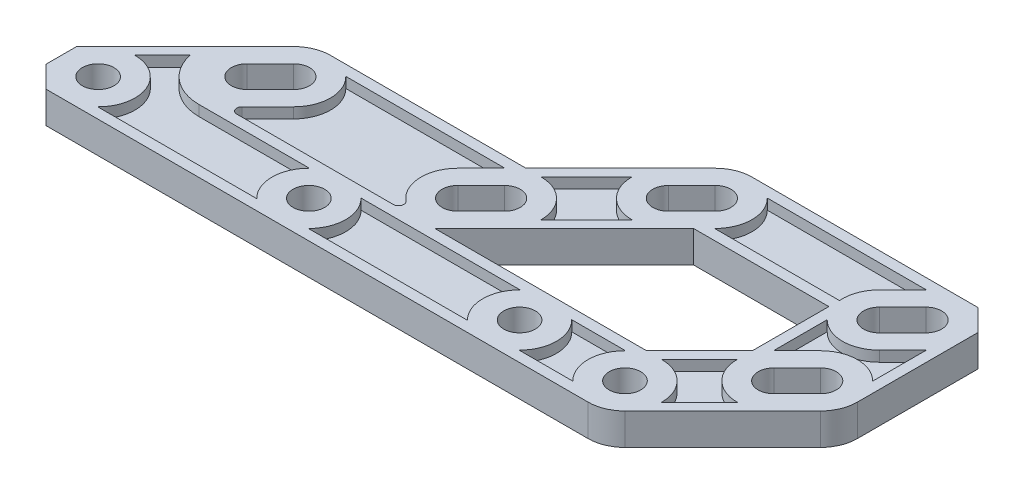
SolidWorks part; units mm, degrees
ref_plane "Front" through (0, 0, 0) normal (0, 0, 1) x (1, 0, 0)
ref_plane "Top" through (0, 0, 0) normal (0, 1, 0) x (1, 0, 0)
ref_plane "Right" through (0, 0, 0) normal (1, 0, 0) x (0, 0, -1)
sketch "Esquisse1" plane through (0, 0, 0) normal (0, 1, 0) x (1, 0, 0)
  line L0 (0, 0) -> (50, 0) construction
  line L1 (0, 3.5) -> (50, 3.5)
  line L2 (0, -3.5) -> (50, -3.5)
  line L3 (57.0711, 7.0711) -> (59.2783, 9.2783) construction
  line L4 (54.5962, 9.5459) -> (56.8034, 11.7531)
  line L5 (59.5459, 4.5962) -> (61.7531, 6.8034)
  line L6 (57.0711, 7.0711) -> (59.2783, 9.2783) construction
  line L7 (56.0104, 8.1317) -> (58.2176, 10.3389)
  line L8 (58.1317, 6.0104) -> (60.3389, 8.2176)
  line L9 (58.1317, 16.0104) -> (60.3389, 18.2176)
  line L10 (56.0104, 18.1317) -> (58.2176, 20.3389)
  line L11 (59.5459, 14.5962) -> (61.7531, 16.8034)
  line L12 (54.5962, 19.5459) -> (56.8034, 21.7531)
  line L13 (57.0711, 17.0711) -> (59.2783, 19.2783) construction
  line L14 (57.0711, 17.0711) -> (59.2783, 19.2783) construction
  line L15 (20, 0) -> (39.2783, 19.2783) construction
  line L16 (39.2783, 19.2783) -> (59.2783, 19.2783) construction
  line L17 (27.0711, 7.0711) -> (29.2783, 9.2783) construction
  line L18 (24.5962, 9.5459) -> (26.8034, 11.7531)
  line L19 (29.5459, 4.5962) -> (31.7531, 6.8034)
  line L20 (27.0711, 7.0711) -> (29.2783, 9.2783) construction
  line L21 (26.0104, 8.1317) -> (28.2176, 10.3389)
  line L22 (28.1317, 6.0104) -> (30.3389, 8.2176)
  line L23 (39.2783, 19.2783) -> (37.0711, 17.0711) construction
  line L24 (41.7531, 16.8034) -> (39.5459, 14.5962)
  line L25 (36.8034, 21.7531) -> (34.5962, 19.5459)
  line L26 (39.2783, 19.2783) -> (37.0711, 17.0711) construction
  line L27 (40.3389, 18.2176) -> (38.1317, 16.0104)
  line L28 (38.2176, 20.3389) -> (36.0104, 18.1317)
  line L29 (0, 0) -> (9.2783, 9.2783) construction
  line L30 (9.2783, 9.2783) -> (29.2783, 9.2783) construction
  line L31 (9.2783, 9.2783) -> (7.0711, 7.0711) construction
  line L32 (11.7531, 6.8034) -> (9.5459, 4.5962)
  line L33 (6.8034, 11.7531) -> (4.5962, 9.5459)
  line L34 (9.2783, 9.2783) -> (7.0711, 7.0711) construction
  line L35 (10.3389, 8.2176) -> (8.1317, 6.0104)
  line L36 (8.2176, 10.3389) -> (6.0104, 8.1317)
  line L38 (-1.4497, 3.5) -> (-3.5, 1.4497)
  line L39 (-3.5, 1.4497) -> (-3.5, -1.4497)
  line L40 (-3.5, -1.4497) -> (-1.4497, -3.5)
  line L41 (-1.4497, -3.5) -> (1.4497, -3.5)
  line L42 (1.4497, -3.5) -> (3.5, -1.4497)
  line L43 (3.5, -1.4497) -> (3.5, 1.4497)
  line L44 (3.5, 1.4497) -> (1.4497, 3.5)
  line L45 (1.4497, 3.5) -> (-1.4497, 3.5)
  line L46 (62.7783, 20.728) -> (60.728, 22.7783)
  line L47 (60.728, 22.7783) -> (57.8285, 22.7783)
  line L48 (57.8285, 22.7783) -> (55.7783, 20.728)
  line L49 (55.7783, 20.728) -> (55.7783, 17.8285)
  line L50 (55.7783, 17.8285) -> (57.8285, 15.7783)
  line L51 (57.8285, 15.7783) -> (60.728, 15.7783)
  line L52 (60.728, 15.7783) -> (62.7783, 17.8285)
  line L53 (62.7783, 17.8285) -> (62.7783, 20.728)
  circle A0 centre (0, 0) radius 1.5
  circle A1 centre (10, 0) radius 1.5
  circle A2 centre (20, 0) radius 1.5
  circle A3 centre (30, 0) radius 1.5
  circle A4 centre (40, 0) radius 1.5
  circle A5 centre (50, 0) radius 1.5
  arc A7 (0, 3.5) -> (0, -3.5) centre (0, 0) ccw
  arc A8 (50, -3.5) -> (50, 3.5) centre (50, 0) ccw
  arc A9 (54.5962, 9.5459) -> (59.5459, 4.5962) centre (57.0711, 7.0711) ccw
  arc A10 (61.7531, 6.8034) -> (56.8034, 11.7531) centre (59.2783, 9.2783) ccw
  arc A11 (56.0104, 8.1317) -> (58.1317, 6.0104) centre (57.0711, 7.0711) ccw
  arc A12 (60.3389, 8.2176) -> (58.2176, 10.3389) centre (59.2783, 9.2783) ccw
  arc A13 (56.0104, 18.1317) -> (58.1317, 16.0104) centre (57.0711, 17.0711) ccw
  arc A14 (60.3389, 18.2176) -> (58.2176, 20.3389) centre (59.2783, 19.2783) ccw
  arc A15 (54.5962, 19.5459) -> (59.5459, 14.5962) centre (57.0711, 17.0711) ccw
  arc A16 (61.7531, 16.8034) -> (56.8034, 21.7531) centre (59.2783, 19.2783) ccw
  arc A17 (24.5962, 9.5459) -> (29.5459, 4.5962) centre (27.0711, 7.0711) ccw
  arc A18 (31.7531, 6.8034) -> (26.8034, 11.7531) centre (29.2783, 9.2783) ccw
  arc A19 (26.0104, 8.1317) -> (28.1317, 6.0104) centre (27.0711, 7.0711) ccw
  arc A20 (30.3389, 8.2176) -> (28.2176, 10.3389) centre (29.2783, 9.2783) ccw
  arc A21 (41.7531, 16.8034) -> (36.8034, 21.7531) centre (39.2783, 19.2783) ccw
  arc A22 (34.5962, 19.5459) -> (39.5459, 14.5962) centre (37.0711, 17.0711) ccw
  arc A23 (40.3389, 18.2176) -> (38.2176, 20.3389) centre (39.2783, 19.2783) ccw
  arc A24 (36.0104, 18.1317) -> (38.1317, 16.0104) centre (37.0711, 17.0711) ccw
  arc A25 (11.7531, 6.8034) -> (6.8034, 11.7531) centre (9.2783, 9.2783) ccw
  arc A26 (4.5962, 9.5459) -> (9.5459, 4.5962) centre (7.0711, 7.0711) ccw
  arc A27 (10.3389, 8.2176) -> (8.2176, 10.3389) centre (9.2783, 9.2783) ccw
  arc A28 (6.0104, 8.1317) -> (8.1317, 6.0104) centre (7.0711, 7.0711) ccw
  circle A29 centre (0, 0) radius 3.5 construction
  circle A30 centre (59.2783, 19.2783) radius 3.5 construction
  point P3 (25, 0)
  point P20 (58.1747, 8.1747)
  point P27 (58.1747, 8.1747)
  point P36 (58.1747, 18.1747)
  point P43 (58.1747, 18.1747)
  point P50 (28.1747, 8.1747)
  point P55 (28.1747, 8.1747)
  point P62 (38.1747, 18.1747)
  point P70 (38.1747, 18.1747)
  point P78 (8.1747, 8.1747)
  point P86 (8.1747, 8.1747)
  dimension "D1" = 3
  dimension "D4" = 7
  dimension "D5" = 3.5
  dimension "D9" = 1.5
  dimension "D3" = 20
  dimension "D6" = 45
  dimension "D7" = 10
  dimension "D8" = 60
  dimension "D11" = 10
  dimension "D12" = 45
  dimension "D2" = 6
  dimension "D10" = 2
sketch "Esquisse2" plane through (0, 0, 0) normal (0, 1, 0) x (1, 0, 0)
  line L0 (0, -3.5) -> (50, -3.5) construction
  line L1 (-1.4497, -3.5) -> (50, -3.5)
  line L2 (59.5459, 4.5962) -> (61.7531, 6.8034) construction
  line L3 (52.4749, -2.4749) -> (61.7531, 6.8034)
  line L4 (36.8034, 21.7531) -> (34.5962, 19.5459) construction
  line L5 (36.8034, 21.7531) -> (27.8285, 12.7783)
  line L6 (6.8034, 11.7531) -> (4.5962, 9.5459) construction
  line L7 (6.8034, 11.7531) -> (-3.5, 1.4497)
  line L8 (62.7783, 9.2783) -> (62.7783, 20.728)
  line L9 (60.728, 22.7783) -> (39.2783, 22.7783)
  line L10 (9.2783, 12.7783) -> (27.8285, 12.7783)
  line L11 (58.1317, 6.0104) -> (60.3389, 8.2176) construction
  line L12 (56.0104, 8.1317) -> (58.2176, 10.3389) construction
  line L13 (58.1317, 6.0104) -> (60.3389, 8.2176)
  line L14 (56.0104, 8.1317) -> (58.2176, 10.3389)
  line L15 (56.0104, 18.1317) -> (58.2176, 20.3389) construction
  line L16 (58.1317, 16.0104) -> (60.3389, 18.2176) construction
  line L17 (56.0104, 18.1317) -> (58.2176, 20.3389)
  line L18 (58.1317, 16.0104) -> (60.3389, 18.2176)
  line L19 (38.2176, 20.3389) -> (36.0104, 18.1317) construction
  line L20 (40.3389, 18.2176) -> (38.1317, 16.0104) construction
  line L21 (38.2176, 20.3389) -> (36.0104, 18.1317)
  line L22 (40.3389, 18.2176) -> (38.1317, 16.0104)
  line L23 (26.0104, 8.1317) -> (28.2176, 10.3389) construction
  line L24 (28.1317, 6.0104) -> (30.3389, 8.2176) construction
  line L25 (26.0104, 8.1317) -> (28.2176, 10.3389)
  line L26 (28.1317, 6.0104) -> (30.3389, 8.2176)
  line L27 (10.3389, 8.2176) -> (8.1317, 6.0104) construction
  line L28 (8.2176, 10.3389) -> (6.0104, 8.1317) construction
  line L29 (10.3389, 8.2176) -> (8.1317, 6.0104)
  line L30 (8.2176, 10.3389) -> (6.0104, 8.1317)
  line L31 (29.5459, 4.5962) -> (31.7531, 6.8034) construction
  line L32 (0, 3.5) -> (50, 3.5) construction
  line L33 (28.4497, 3.5) -> (40.728, 15.7783)
  line L34 (28.4497, 3.5) -> (48.5503, 3.5)
  line L35 (54.5962, 9.5459) -> (56.8034, 11.7531) construction
  line L36 (48.5503, 3.5) -> (53.5711, 8.5208)
  line L37 (53.5711, 15.7783) -> (53.5711, 8.5208)
  line L38 (53.5711, 15.7783) -> (40.728, 15.7783)
  line L39 (-3.5, -1.4497) -> (-1.4497, -3.5) construction
  line L40 (-3.5, 1.4497) -> (-3.5, -1.4497) construction
  line L41 (-3.5, -1.4497) -> (-1.4497, -3.5)
  line L42 (-3.5, 1.4497) -> (-3.5, -1.4497)
  line L43 (62.7783, 20.728) -> (60.728, 22.7783) construction
  line L44 (62.7783, 20.728) -> (60.728, 22.7783)
  arc A2 (50, -3.5) -> (50, 3.5) centre (50, 0) ccw construction
  arc A3 (50, -3.5) -> (52.4749, -2.4749) centre (50, 0) ccw
  arc A4 (61.7531, 6.8034) -> (56.8034, 11.7531) centre (59.2783, 9.2783) ccw construction
  arc A5 (61.7531, 6.8034) -> (62.7783, 9.2783) centre (59.2783, 9.2783) ccw
  arc A6 (41.7531, 16.8034) -> (36.8034, 21.7531) centre (39.2783, 19.2783) ccw construction
  arc A8 (39.2783, 22.7783) -> (36.8034, 21.7531) centre (39.2783, 19.2783) ccw
  arc A10 (11.7531, 6.8034) -> (6.8034, 11.7531) centre (9.2783, 9.2783) ccw construction
  arc A11 (9.2783, 12.7783) -> (6.8034, 11.7531) centre (9.2783, 9.2783) ccw
  circle A12 centre (50, 0) radius 1.5 construction
  circle A13 centre (40, 0) radius 1.5 construction
  circle A14 centre (20, 0) radius 1.5 construction
  circle A15 centre (0, 0) radius 1.5 construction
  circle A16 centre (50, 0) radius 1.5
  circle A17 centre (40, 0) radius 1.5
  circle A18 centre (20, 0) radius 1.5
  circle A19 centre (0, 0) radius 1.5
  arc A20 (56.0104, 8.1317) -> (58.1317, 6.0104) centre (57.0711, 7.0711) ccw construction
  arc A21 (60.3389, 8.2176) -> (58.2176, 10.3389) centre (59.2783, 9.2783) ccw construction
  arc A22 (56.0104, 8.1317) -> (58.1317, 6.0104) centre (57.0711, 7.0711) ccw
  arc A23 (60.3389, 8.2176) -> (58.2176, 10.3389) centre (59.2783, 9.2783) ccw
  arc A24 (60.3389, 18.2176) -> (58.2176, 20.3389) centre (59.2783, 19.2783) ccw construction
  arc A25 (56.0104, 18.1317) -> (58.1317, 16.0104) centre (57.0711, 17.0711) ccw construction
  arc A26 (60.3389, 18.2176) -> (58.2176, 20.3389) centre (59.2783, 19.2783) ccw
  arc A27 (56.0104, 18.1317) -> (58.1317, 16.0104) centre (57.0711, 17.0711) ccw
  arc A28 (40.3389, 18.2176) -> (38.2176, 20.3389) centre (39.2783, 19.2783) ccw construction
  arc A29 (36.0104, 18.1317) -> (38.1317, 16.0104) centre (37.0711, 17.0711) ccw construction
  arc A30 (40.3389, 18.2176) -> (38.2176, 20.3389) centre (39.2783, 19.2783) ccw
  arc A31 (36.0104, 18.1317) -> (38.1317, 16.0104) centre (37.0711, 17.0711) ccw
  arc A32 (26.0104, 8.1317) -> (28.1317, 6.0104) centre (27.0711, 7.0711) ccw construction
  arc A33 (30.3389, 8.2176) -> (28.2176, 10.3389) centre (29.2783, 9.2783) ccw construction
  arc A34 (26.0104, 8.1317) -> (28.1317, 6.0104) centre (27.0711, 7.0711) ccw
  arc A35 (30.3389, 8.2176) -> (28.2176, 10.3389) centre (29.2783, 9.2783) ccw
  arc A36 (10.3389, 8.2176) -> (8.2176, 10.3389) centre (9.2783, 9.2783) ccw construction
  arc A37 (6.0104, 8.1317) -> (8.1317, 6.0104) centre (7.0711, 7.0711) ccw construction
  arc A38 (10.3389, 8.2176) -> (8.2176, 10.3389) centre (9.2783, 9.2783) ccw
  arc A39 (6.0104, 8.1317) -> (8.1317, 6.0104) centre (7.0711, 7.0711) ccw
  arc A40 (54.5962, 19.5459) -> (59.5459, 14.5962) centre (57.0711, 17.0711) ccw construction
  dimension "D1" = 7
extrude "Boss.-Extru.1" add sketch "Esquisse2" along normal mid plane 3
sketch "Esquisse3" plane through (0, 0, 0) normal (0, 1, 0) x (1, 0, 0)
  line L10 (61.7783, 20.3138) -> (60.3138, 21.7783)
  line L11 (61.7783, 20.3138) -> (60.3138, 21.7783)
  line L12 (6.8034, 11.7531) -> (4.5962, 9.5459) construction
  line L13 (11.7531, 6.8034) -> (9.5459, 4.5962) construction
  line L14 (-1.0355, -2.5) -> (50, -2.5)
  line L15 (51.7678, -1.7678) -> (61.046, 7.5105)
  line L16 (61.7783, 9.2783) -> (61.7783, 20.3138)
  line L17 (60.3138, 21.7783) -> (39.2783, 21.7783)
  line L18 (37.5105, 21.046) -> (28.2427, 11.7783)
  line L19 (28.2427, 11.7783) -> (9.2783, 11.7783)
  line L20 (7.5105, 11.046) -> (-2.5, 1.0355)
  line L21 (-1.0355, -2.5) -> (50, -2.5)
  line L22 (51.7678, -1.7678) -> (61.046, 7.5105)
  line L23 (61.7783, 9.2783) -> (61.7783, 20.3138)
  line L24 (60.3138, 21.7783) -> (39.2783, 21.7783)
  line L25 (37.5105, 21.046) -> (28.2427, 11.7783)
  line L26 (28.2427, 11.7783) -> (9.2783, 11.7783)
  line L27 (7.5105, 11.046) -> (-2.5, 1.0355)
  line L28 (6.8034, 11.7531) -> (4.5962, 9.5459)
  line L29 (11.7531, 6.8034) -> (9.5459, 4.5962)
  line L30 (24.5962, 9.5459) -> (26.8034, 11.7531) construction
  line L31 (26.0355, 2.5) -> (48.9645, 2.5)
  line L32 (48.9645, 2.5) -> (54.5711, 8.1066)
  line L33 (54.5711, 8.1066) -> (54.5711, 16.7783)
  line L34 (54.5711, 16.7783) -> (40.3138, 16.7783)
  line L35 (40.3138, 16.7783) -> (26.0355, 2.5)
  line L36 (26.0355, 2.5) -> (48.9645, 2.5)
  line L37 (48.9645, 2.5) -> (54.5711, 8.1066)
  line L38 (54.5711, 8.1066) -> (54.5711, 16.7783)
  line L39 (54.5711, 16.7783) -> (40.3138, 16.7783)
  line L40 (40.3138, 16.7783) -> (26.0355, 2.5)
  line L41 (29.5459, 4.5962) -> (31.7531, 6.8034) construction
  line L42 (24.5962, 9.5459) -> (26.8034, 11.7531)
  line L43 (29.5459, 4.5962) -> (31.7531, 6.8034)
  line L44 (36.8034, 21.7531) -> (34.5962, 19.5459) construction
  line L45 (41.7531, 16.8034) -> (39.5459, 14.5962) construction
  line L46 (36.8034, 21.7531) -> (34.5962, 19.5459)
  line L47 (41.7531, 16.8034) -> (39.5459, 14.5962)
  line L48 (54.5962, 19.5459) -> (56.8034, 21.7531) construction
  line L49 (59.5459, 14.5962) -> (61.7531, 16.8034) construction
  line L50 (54.5962, 19.5459) -> (56.8034, 21.7531)
  line L51 (59.5459, 14.5962) -> (61.7531, 16.8034)
  line L52 (59.5459, 4.5962) -> (61.7531, 6.8034) construction
  line L53 (54.5962, 9.5459) -> (56.8034, 11.7531) construction
  line L54 (59.5459, 4.5962) -> (61.7531, 6.8034)
  line L55 (54.5962, 9.5459) -> (56.8034, 11.7531)
  line L56 (-2.5, 1.0355) -> (-2.5, -1.0355)
  line L57 (-2.5, 1.0355) -> (-2.5, -1.0355)
  line L58 (-2.5, -1.0355) -> (-1.0355, -2.5)
  line L59 (-2.5, -1.0355) -> (-1.0355, -2.5)
  arc A6 (11.7531, 6.8034) -> (6.8034, 11.7531) centre (9.2783, 9.2783) ccw construction
  arc A7 (4.5962, 9.5459) -> (9.5459, 4.5962) centre (7.0711, 7.0711) ccw construction
  arc A8 (11.7531, 6.8034) -> (6.8034, 11.7531) centre (9.2783, 9.2783) ccw
  arc A9 (4.5962, 9.5459) -> (9.5459, 4.5962) centre (7.0711, 7.0711) ccw
  arc A10 (31.7531, 6.8034) -> (26.8034, 11.7531) centre (29.2783, 9.2783) ccw construction
  arc A11 (24.5962, 9.5459) -> (29.5459, 4.5962) centre (27.0711, 7.0711) ccw construction
  arc A12 (50, -2.5) -> (51.7678, -1.7678) centre (50, 0) ccw
  arc A13 (61.046, 7.5105) -> (61.7783, 9.2783) centre (59.2783, 9.2783) ccw
  arc A15 (39.2783, 21.7783) -> (37.5105, 21.046) centre (39.2783, 19.2783) ccw
  arc A16 (9.2783, 11.7783) -> (7.5105, 11.046) centre (9.2783, 9.2783) ccw
  arc A18 (50, -2.5) -> (51.7678, -1.7678) centre (50, 0) ccw
  arc A19 (61.046, 7.5105) -> (61.7783, 9.2783) centre (59.2783, 9.2783) ccw
  arc A21 (39.2783, 21.7783) -> (37.5105, 21.046) centre (39.2783, 19.2783) ccw
  arc A22 (9.2783, 11.7783) -> (7.5105, 11.046) centre (9.2783, 9.2783) ccw
  arc A24 (31.7531, 6.8034) -> (26.8034, 11.7531) centre (29.2783, 9.2783) ccw
  arc A25 (24.5962, 9.5459) -> (29.5459, 4.5962) centre (27.0711, 7.0711) ccw
  arc A26 (41.7531, 16.8034) -> (36.8034, 21.7531) centre (39.2783, 19.2783) ccw construction
  arc A27 (34.5962, 19.5459) -> (39.5459, 14.5962) centre (37.0711, 17.0711) ccw construction
  arc A28 (41.7531, 16.8034) -> (36.8034, 21.7531) centre (39.2783, 19.2783) ccw
  arc A29 (34.5962, 19.5459) -> (39.5459, 14.5962) centre (37.0711, 17.0711) ccw
  arc A30 (61.7531, 16.8034) -> (56.8034, 21.7531) centre (59.2783, 19.2783) ccw construction
  arc A31 (54.5962, 19.5459) -> (59.5459, 14.5962) centre (57.0711, 17.0711) ccw construction
  arc A32 (61.7531, 16.8034) -> (56.8034, 21.7531) centre (59.2783, 19.2783) ccw
  arc A33 (54.5962, 19.5459) -> (59.5459, 14.5962) centre (57.0711, 17.0711) ccw
  arc A34 (54.5962, 9.5459) -> (59.5459, 4.5962) centre (57.0711, 7.0711) ccw construction
  arc A35 (61.7531, 6.8034) -> (56.8034, 11.7531) centre (59.2783, 9.2783) ccw construction
  arc A36 (54.5962, 9.5459) -> (59.5459, 4.5962) centre (57.0711, 7.0711) ccw
  arc A37 (61.7531, 6.8034) -> (56.8034, 11.7531) centre (59.2783, 9.2783) ccw
  circle A38 centre (0, 0) radius 3.5
  circle A39 centre (20, 0) radius 3.5
  circle A40 centre (40, 0) radius 3.5
  circle A41 centre (50, 0) radius 3.5
  dimension "D1" = 1
  dimension "D2" = 1
sketch "Esquisse4" plane through (0, 0, 0) normal (0, 1, 0) x (1, 0, 0)
  line L0 (-1.0355, -2.5) -> (50, -2.5) construction
  line L1 (2.4495, -2.5) -> (17.5505, -2.5)
  line L2 (26.0355, 2.5) -> (48.9645, 2.5) construction
  line L3 (7.0711, 2.5) -> (17.5505, 2.5)
  line L4 (22.4495, -2.5) -> (37.5505, -2.5)
  line L5 (22.4495, 2.5) -> (37.5505, 2.5)
  line L7 (42.4495, 2.5) -> (47.5505, 2.5)
  line L8 (42.4495, -2.5) -> (47.5505, -2.5)
  line L9 (51.7678, -1.7678) -> (61.046, 7.5105) construction
  line L11 (53.4998, -0.0357) -> (57.1068, 3.5713)
  line L12 (50, 3.5) -> (53.5713, 7.1068)
  line L13 (54.5711, 8.1066) -> (54.5711, 16.7783) construction
  line L14 (59.5459, 14.5962) -> (61.7531, 16.8034) construction
  line L15 (61.7783, 9.2783) -> (61.7783, 20.3138) construction
  line L16 (54.5962, 9.5459) -> (56.8034, 11.7531) construction
  line L17 (54.5711, 9.5208) -> (54.5711, 14.6216)
  line L18 (59.5459, 14.5962) -> (61.7783, 16.8285)
  line L19 (61.7783, 11.7278) -> (61.7783, 16.8285)
  line L20 (54.5711, 9.5208) -> (56.8034, 11.7531)
  line L21 (60.3138, 21.7783) -> (39.2783, 21.7783) construction
  line L22 (54.5962, 19.5459) -> (56.8034, 21.7531) construction
  line L23 (54.5711, 16.7783) -> (40.3138, 16.7783) construction
  line L24 (56.8285, 21.7783) -> (41.7278, 21.7783)
  line L25 (54.5962, 19.5459) -> (56.8285, 21.7783)
  line L26 (53.5833, 16.7783) -> (41.7278, 16.7783)
  line L27 (37.5105, 21.046) -> (28.2427, 11.7783) construction
  line L28 (40.3138, 16.7783) -> (26.0355, 2.5) construction
  line L29 (33.5713, 17.1068) -> (29.2426, 12.7781)
  line L30 (37.1068, 13.5713) -> (32.7781, 9.2426)
  line L31 (28.2427, 11.7783) -> (9.2783, 11.7783) construction
  line L32 (24.5962, 9.5459) -> (26.8034, 11.7531) construction
  line L33 (0, 3.5) -> (50, 3.5) construction
  line L34 (11.7531, 6.8034) -> (9.5459, 4.5962) construction
  line L35 (26.8285, 11.7783) -> (11.7278, 11.7783)
  line L36 (24.5962, 9.5459) -> (26.8285, 11.7783)
  line L37 (9.6569, 3.5) -> (24.5082, 3.5)
  line L38 (11.7531, 6.8034) -> (9.3033, 4.3536)
  line L40 (48.9645, 2.5) -> (54.5711, 8.1066) construction
  line L41 (7.5105, 11.046) -> (-2.5, 1.0355) construction
  line L42 (2.5973, 6.1329) -> (-0.0357, 3.4998)
  circle A0 centre (0, 0) radius 3.5 construction
  arc A1 (2.4495, -2.5) -> (-0.0357, 3.4998) centre (0, 0) ccw
  circle A2 centre (20, 0) radius 3.5 construction
  arc A3 (17.5505, 2.5) -> (17.5505, -2.5) centre (20, 0) ccw
  circle A4 centre (40, 0) radius 3.5 construction
  arc A5 (37.5505, 2.5) -> (37.5505, -2.5) centre (40, 0) ccw
  arc A6 (22.4495, -2.5) -> (22.4495, 2.5) centre (20, 0) ccw
  circle A7 centre (50, 0) radius 3.5 construction
  arc A8 (47.5505, 2.5) -> (47.5505, -2.5) centre (50, 0) ccw
  arc A9 (42.4495, -2.5) -> (42.4495, 2.5) centre (40, 0) ccw
  arc A10 (54.5962, 9.5459) -> (59.5459, 4.5962) centre (57.0711, 7.0711) ccw construction
  arc A11 (50, -3.5) -> (50, 3.5) centre (50, 0) ccw construction
  arc A12 (53.5713, 7.1068) -> (57.1068, 3.5713) centre (57.0711, 7.0711) ccw
  arc A13 (53.4998, -0.0357) -> (50, 3.5) centre (50, 0) ccw
  arc A14 (54.5962, 19.5459) -> (59.5459, 14.5962) centre (57.0711, 17.0711) ccw construction
  arc A15 (61.7531, 6.8034) -> (56.8034, 11.7531) centre (59.2783, 9.2783) ccw construction
  arc A16 (54.5711, 14.6216) -> (59.5459, 14.5962) centre (57.0711, 17.0711) ccw
  arc A17 (61.7783, 11.7278) -> (56.8034, 11.7531) centre (59.2783, 9.2783) ccw
  arc A18 (41.7531, 16.8034) -> (36.8034, 21.7531) centre (39.2783, 19.2783) ccw construction
  arc A19 (41.7278, 16.7783) -> (41.7278, 21.7783) centre (39.2783, 19.2783) ccw
  arc A20 (54.5962, 19.5459) -> (53.5833, 16.7783) centre (57.0711, 17.0711) ccw
  arc A21 (31.7531, 6.8034) -> (26.8034, 11.7531) centre (29.2783, 9.2783) ccw construction
  arc A22 (34.5962, 19.5459) -> (39.5459, 14.5962) centre (37.0711, 17.0711) ccw construction
  arc A23 (32.7781, 9.2426) -> (29.2426, 12.7781) centre (29.2783, 9.2783) ccw
  arc A24 (33.5713, 17.1068) -> (37.1068, 13.5713) centre (37.0711, 17.0711) ccw
  arc A25 (24.5962, 9.5459) -> (29.5459, 4.5962) centre (27.0711, 7.0711) ccw construction
  arc A26 (24.5962, 9.5459) -> (24.8285, 4.3839) centre (27.0711, 7.0711) ccw
  arc A27 (11.7531, 6.8034) -> (6.8034, 11.7531) centre (9.2783, 9.2783) ccw construction
  arc A28 (11.7531, 6.8034) -> (11.7278, 11.7783) centre (9.2783, 9.2783) ccw
  arc A29 (9.6569, 3.5) -> (9.3033, 4.3536) centre (9.6569, 4) cw
  arc A30 (24.5082, 3.5) -> (24.8285, 4.3839) centre (24.5082, 4) ccw
  arc A31 (7.0711, 2.5) -> (2.5973, 6.1329) centre (7.0711, 7.0711) cw
  dimension "D1" = 0.5
  dimension "D2" = 0.5
extrude "Enlèv. mat.-Extru.1" cut sketch "Esquisse4" against normal blind 3 from offset 0.5
mirror "Symétrie1" about plane through (0, 0, 0) normal (0, 1, 0) of "Enlèv. mat.-Extru.1"
